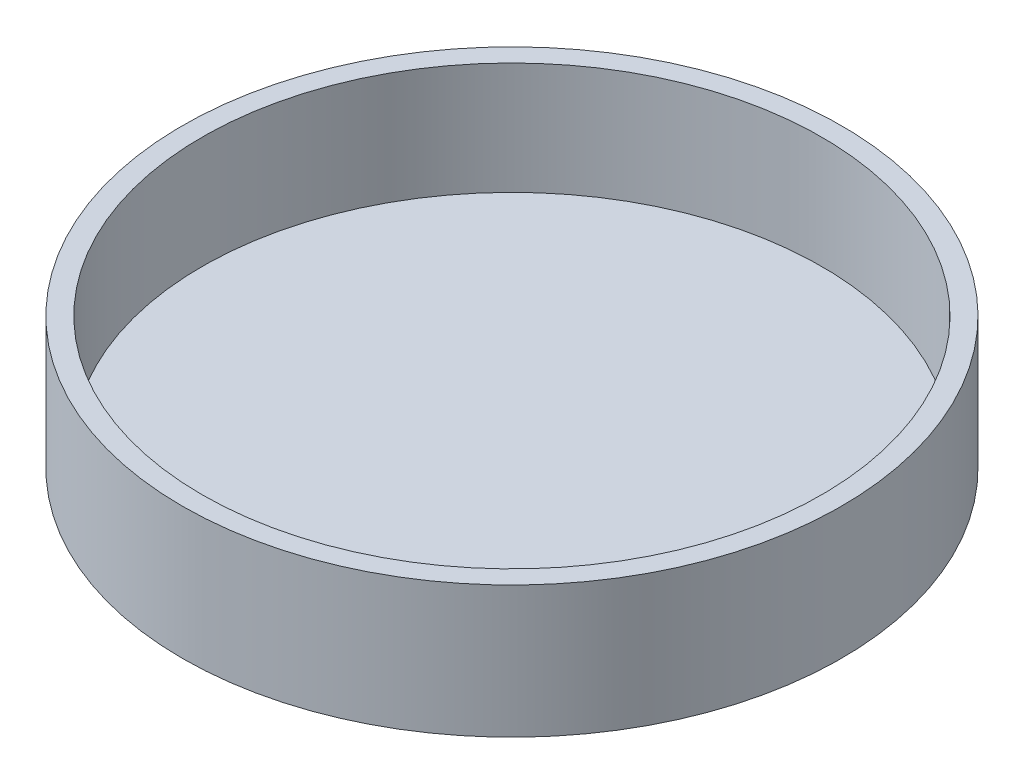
SolidWorks part; units mm, degrees
ref_plane "Front" through (0, 0, 0) normal (0, 0, 1) x (1, 0, 0)
ref_plane "Top" through (0, 0, 0) normal (0, 1, 0) x (1, 0, 0)
ref_plane "Right" through (0, 0, 0) normal (1, 0, 0) x (0, 0, -1)
sketch "Sketch1" plane through (0, 0, 0) normal (0, 1, 0) x (1, 0, 0)
  circle A0 centre (0, 0) radius 25
  point P3 (0, 0)
  dimension "D1" = 50
extrude "Boss-Extrude1" add sketch "Sketch1" along normal blind 10 contours A0
shell "Shell1" thickness 1.5
